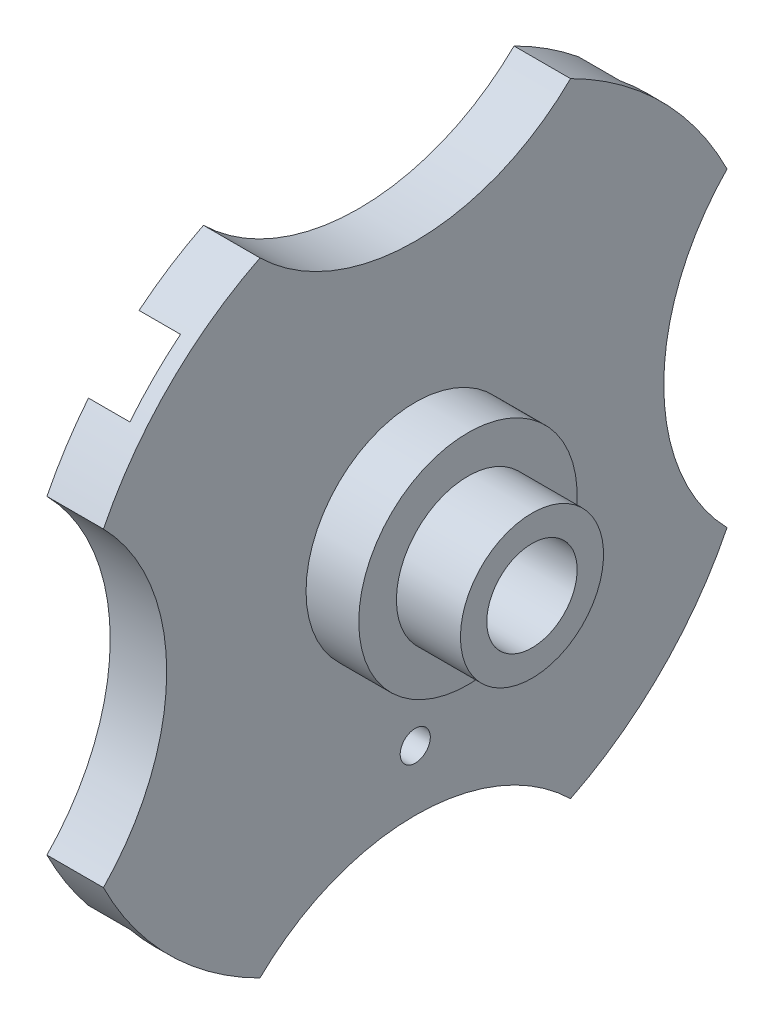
SolidWorks part; units mm, degrees
ref_plane "Plan1" through (0, 0, 0) normal (0, 0, 1) x (1, 0, 0)
ref_plane "Plan2" through (0, 0, 0) normal (0, 1, 0) x (1, 0, 0)
ref_plane "Plan3" through (0, 0, 0) normal (1, 0, 0) x (0, 0, -1)
sketch "Esquisse1" plane through (0, 0, 0) normal (0, 0, 1) x (1, 0, 0)
  line L0 (0, 0) -> (90, 0) construction
  line L1 (0, 24) -> (0, 92.5)
  line L2 (0, 92.5) -> (15, 92.5)
  line L3 (15, 92.5) -> (15, 29)
  line L4 (15, 29) -> (29, 29)
  line L5 (29, 29) -> (29, 19)
  line L6 (29, 19) -> (46, 19)
  line L7 (46, 19) -> (46, 12)
  line L8 (0, 24) -> (17, 24)
  line L9 (17, 24) -> (17, 12)
  line L10 (17, 12) -> (46, 12)
  dimension "D1" = 92.5
  dimension "D2" = 15
  dimension "D3" = 14
  dimension "D4" = 17
  dimension "D5" = 12
  dimension "D6" = 24
  dimension "D7" = 19
  dimension "D8" = 29
  dimension "D9" = 17
revolve "Base-Révolution" add sketch "Esquisse1" angle 360 about L0
sketch "Esquisse2" plane through (0, 0, 0) normal (-1, 0, 0) x (0, 0, 1)
  circle A0 centre (0, 125) radius 59
  circle A1 centre (0, 0) radius 92.5 construction
  circle A2 centre (125, 0) radius 59
  circle A3 centre (0, -125) radius 59
  circle A4 centre (-125, 0) radius 59
  dimension "D1" = 125
  dimension "D2" = 118
extrude "Enlèv. mat.-Extru.1" cut sketch "Esquisse2" against normal through all
sketch "Esquisse3" plane through (0, 0, 0) normal (-1, 0, 0) x (0, 0, 1)
  line L0 (18.7383, 32.1734) -> (58.344, 71.779)
  line L1 (32.1734, 18.7383) -> (71.779, 58.344)
  line L2 (32.1734, -18.7413) -> (71.779, -58.3469)
  line L3 (18.7383, -32.1763) -> (58.344, -71.782)
  line L4 (-18.7413, -32.1763) -> (-58.3469, -71.782)
  line L5 (-32.1763, -18.7413) -> (-71.782, -58.3469)
  line L6 (-32.1763, 18.7383) -> (-71.782, 58.344)
  line L7 (-18.7413, 32.1734) -> (-58.3469, 71.779)
  arc A0 (41.234, -82.801) -> (82.801, -41.234) centre (0, 0) ccw construction
  arc A1 (71.779, 58.344) -> (58.344, 71.779) centre (0, 0) ccw
  arc A2 (18.7383, 32.1734) -> (32.1734, 18.7383) centre (25.4558, 25.4558) ccw
  arc A3 (58.344, -71.782) -> (71.779, -58.3469) centre (0, -0.0029) ccw
  arc A4 (32.1734, -18.7413) -> (18.7383, -32.1763) centre (25.4558, -25.4588) ccw
  arc A5 (-71.782, -58.3469) -> (-58.3469, -71.782) centre (-0.0029, -0.0029) ccw
  arc A6 (-18.7413, -32.1763) -> (-32.1763, -18.7413) centre (-25.4588, -25.4588) ccw
  arc A7 (-58.3469, 71.779) -> (-71.782, 58.344) centre (-0.0029, 0) ccw
  arc A8 (-32.1763, 18.7383) -> (-18.7413, 32.1734) centre (-25.4588, 25.4558) ccw
  dimension "D1" = 9.5
  dimension "D3" = 9.5
  dimension "D4" = 36
  dimension "D5" = 19
extrude "Enlèv. mat.-Extru.2" cut sketch "Esquisse3" against normal blind 11
sketch "Esquisse4" plane through (0, 0, 0) normal (-1, 0, 0) x (0, 0, 1)
  line L0 (0, 0) -> (0, -83.7775) construction
  circle A0 centre (0, -50) radius 4
  circle A2 centre (0, 0) radius 12 construction
  dimension "D1" = 50
  dimension "D2" = 8
extrude "Enlèv. mat.-Extru.3" cut sketch "Esquisse4" against normal through all
